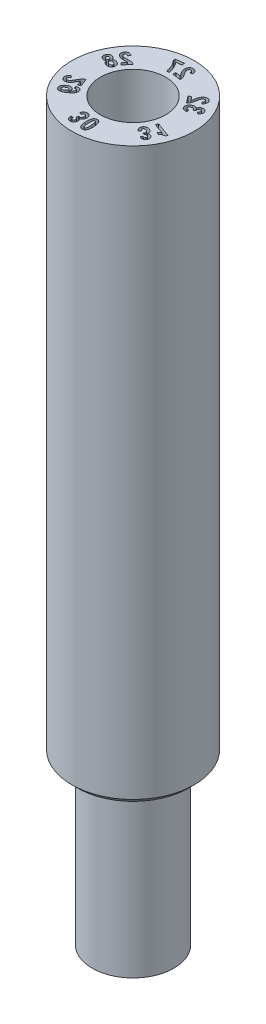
SolidWorks part; units mm, degrees
other "<M2L6-SetScrew>-<Chamfer1>" parameters "D10"=0.14
ref_plane "Front Plane" through (0, 0, 0) normal (0, 0, 1) x (1, 0, 0)
ref_plane "Top Plane" through (0, 0, 0) normal (0, 1, 0) x (1, 0, 0)
ref_plane "Right Plane" through (0, 0, 0) normal (1, 0, 0) x (0, 0, -1)
sketch "Sketch1" plane through (0, 0, 0) normal (0, 0, 1) x (1, 0, 0)
  line L0 (0, 0) -> (0, 67.4202) construction
  line L1 (1, -14) -> (1.36, -14)
  line L3 (1.5, -13.86) -> (1.5, 0)
  line L4 (1.5, 0) -> (0.8, 0)
  line L5 (0.8, 0) -> (0.8, -2)
  line L6 (0.8, -2) -> (0.5, -2)
  line L7 (0.5, -2) -> (0.5, -10.5)
  line L8 (0.5, -10.5) -> (1, -10.5)
  line L9 (1, -10.5) -> (1, -14)
  line L10 (1.36, -14) -> (1.5, -13.86)
  point P4 (1.5, -14)
  dimension "D1" = 3.5
  dimension "D2" = 2
  dimension "D3" = 14
  dimension "D4" = 1
  dimension "D5" = 1.6
  dimension "D6" = 2
  dimension "D7" = 3
revolve "Revolve1" add sketch "Sketch1" angle 360 about L0
sketch "Sketch2" plane through (0, 0, 0) normal (0, 1, 0) x (1, 0, 0)
  line L0 (0, 0) -> (0, 1.7423) construction
  line L1 (0, 0) -> (1.5089, 0.8711) construction
  line L2 (0, 0) -> (1.5089, -0.8711) construction
  line L3 (0, 0) -> (0, -1.7423) construction
  line L4 (0, 0) -> (-1.5089, -0.8711) construction
  line L5 (0, 0) -> (-1.5089, 0.8711) construction
  arc A0 (0.241, 0.921) -> (0.6849, 0.6613) centre (0, 0) ccw construction
  text T0 "27    28    29    30     31    32" font "Arial Narrow" height 0.38
  point P12 (0, 0)
  point P17 (0, 0)
  point P18 (0, 0)
  point P21 (0, 0)
  dimension "D1" = 0.9521
  dimension "D2" = 6
extrude "Cut-Extrude1" cut sketch "Sketch2" against normal blind 0.2
inserted part "M2L6-SetScrew"
move or copy body "Body-Move/Copy2" placed by mates yes
other "Distance1" parameters "D1"=4
